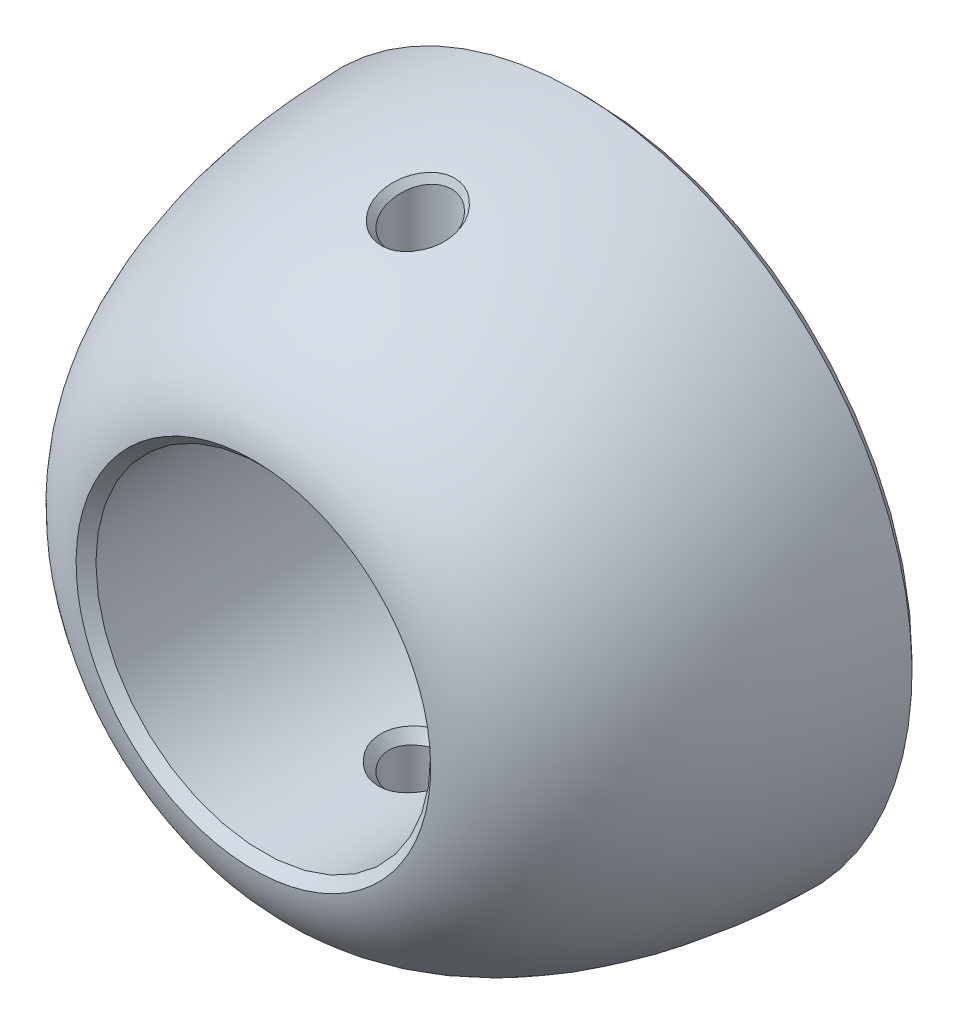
SolidWorks part; units mm, degrees
ref_plane "Спереди" through (0, 0, 0) normal (0, 0, 1) x (1, 0, 0)
ref_plane "Сверху" through (0, 0, 0) normal (0, 1, 0) x (1, 0, 0)
ref_plane "Справа" through (0, 0, 0) normal (1, 0, 0) x (0, 0, -1)
sketch "Эскиз1" plane through (0, 0, 0) normal (1, 0, 0) x (0, 0, -1)
  line L0 (-4, 0) -> (4, 0) construction
  line L1 (-4, 4) -> (4, 4)
  line L2 (4, 4) -> (4, 8)
  ellipse E0 centre (4, 4) end of major axis (-4, 4) minor radius 4 (4, 8) -> (-4, 4) ccw
  dimension "D1" = 8
  dimension "D2" = 8
  dimension "D3" = 16
revolve "Повернуть1" add sketch "Эскиз1" angle 360 about L0
sketch "Эскиз2" plane through (0, 0, 0) normal (0, 1, 0) x (1, 0, 0)
  circle A0 centre (0, 0) radius 0.75
  point P7 (0.054, -3.9861)
  dimension "D1" = 1.5
extrude "Вырез-Вытянуть1" cut sketch "Эскиз2" against normal mid plane 20
chamfer "Фаска1" distance 0.25 angle 45 6 edges at (4, 0, 4) (4, 0, -4) (8, 0, -4) (0.1578, -3.9969, -0.7332) (-0.1578, 3.9969, -0.7332) (-0.1691, 7.2237, 0.7307)
